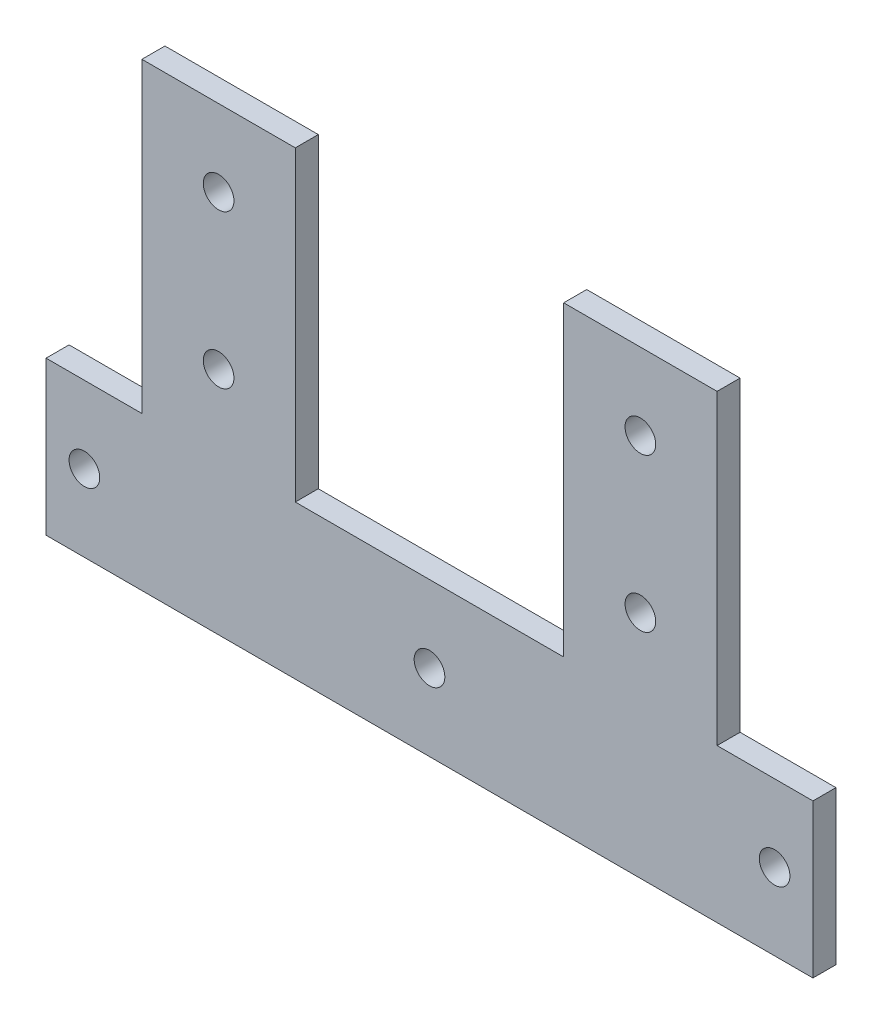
SolidWorks part; units mm, degrees
ref_plane "前视基准面" through (0, 0, 0) normal (0, 0, 1) x (1, 0, 0)
ref_plane "上视基准面" through (0, 0, 0) normal (0, 1, 0) x (1, 0, 0)
ref_plane "右视基准面" through (0, 0, 0) normal (1, 0, 0) x (0, 0, -1)
sketch "草图1" plane through (0, 0, 0) normal (0, 0, 1) x (1, 0, 0)
  line L0 (17.5, 10) -> (17.5, 50)
  line L1 (-50, 10) -> (-37.5, 10)
  line L2 (-50, 10) -> (-50, -10)
  line L3 (-50, -10) -> (50, -10)
  line L4 (50, 10) -> (50, -10)
  line L5 (-50, 10) -> (50, -10) construction
  line L6 (-50, -10) -> (50, 10) construction
  line L7 (17.5, 50) -> (37.5, 50)
  line L8 (37.5, 50) -> (37.5, 10)
  line L9 (37.5, 10) -> (50, 10)
  line L10 (-37.5, 10) -> (-37.5, 50)
  line L11 (-37.5, 50) -> (-17.5, 50)
  line L12 (-17.5, 50) -> (-17.5, 10)
  line L13 (-17.5, 10) -> (17.5, 10)
  point P0 (0, 0)
  dimension "D1" = 20
  dimension "D2" = 20
  dimension "D3" = 100
  dimension "D4" = 12.5
  dimension "D5" = 40
  dimension "D6" = 20
  dimension "D7" = 40
  dimension "D8" = 12.5
extrude "凸台-拉伸1" add sketch "草图1" along normal blind 3
hole_wizard "Ø4.0 (4) 直径孔1" positions "草图2" profile "草图3" hole size "Ø4.0" standard "GB"
sketch "草图2" plane through (0, 0, 3) normal (0, 0, 1) x (1, 0, 0)
  line L0 (37.5, 50) -> (17.5, 50) construction
  line L1 (17.5, 50) -> (17.5, 10) construction
  line L5 (-17.5, 10) -> (-17.5, 50) construction
  line L6 (-17.5, 50) -> (-37.5, 50) construction
  point P0 (27.5, 40)
  point P2 (27.5, 20)
  point P4 (0, 0)
  point P17 (-27.5, 40)
  point P19 (-27.5, 20)
  point P21 (-45, 0)
  point P23 (45, 0)
  point P26 (0, 0)
  point P27 (0, 0)
  point P28 (0, 0)
  point P38 (0, 0)
  dimension "D1" = 20
  dimension "D2" = 45
  dimension "D3" = 45
  dimension "D4" = 10
  dimension "D5" = 10
  dimension "D6" = 10
  dimension "D7" = 10
  dimension "D8" = 20
sketch "草图3" plane through (27.5, 40, 3) normal (1, 0, 0) x (0, -1, 0)
  line L0 (0, 0) -> (0, 3)
  line L1 (0, 3) -> (2, 3)
  line L2 (2, 3) -> (2, 0)
  line L5 (2, 0) -> (0, 0)
  line L11 (0, -6.35) -> (0, 107.95) construction
  dimension "通孔孔直径" = 4
  dimension "通孔孔深度" = 3
